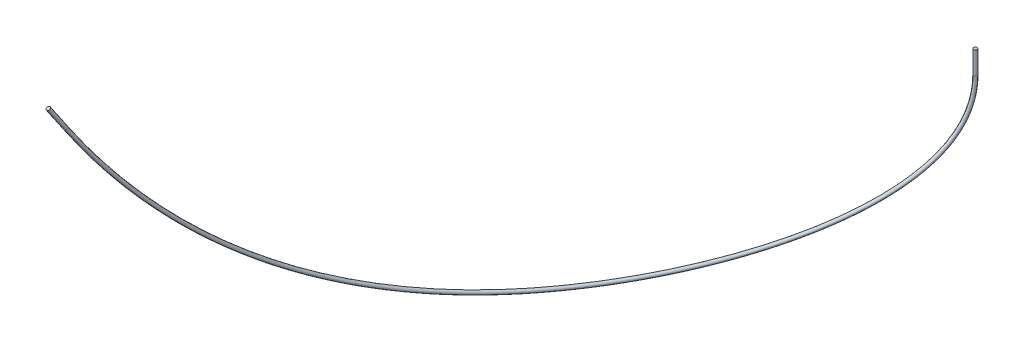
SolidWorks part; units mm, degrees
ref_plane "Front Plane" through (0, 0, 0) normal (0, 0, 1) x (1, 0, 0)
ref_plane "Top Plane" through (0, 0, 0) normal (0, 1, 0) x (1, 0, 0)
ref_plane "Right Plane" through (0, 0, 0) normal (1, 0, 0) x (0, 0, -1)
sketch3d "3DSketch1"
  line L0 (-6.8529, 80.1977, 284.8834) -> (-4.9485, 70.708, 279.0223) construction
  line L1 (129.032, 35.2425, 13.3985) -> (129.032, 25.2349, 13.3985) construction
  line L2 (-6.8529, 80.1977, 284.8834) -> (-4.9485, 70.708, 279.0223)
  line L3 (129.032, 35.2425, 13.3985) -> (129.032, 25.2349, 13.3985)
  spline S0 degree 3 poles (-2782.7074, -14650.3707, 668.3608) (873.5181, 3143.8482, -465.7221) (-835.5199, -1442.9994, 1362.79) (736.8262, 593.8716, -912.6707) (-7439.6142, 3712.3444, 12376.0381) knots -4.626939 -4.626939 -4.626939 -4.626939 0.550656 3.065442 3.065442 3.065442 3.065442 only from (-4.9485, 70.708, 279.0223) to (129.032, 25.2349, 13.3985) construction
  spline S1 degree 3 poles (-4.9485, 70.708, 279.0223) (4.7556, 22.3512, 249.156) (39.1667, -55.9997, 165.9552) (129.032, -22.4119, 13.3985) (129.032, 25.2349, 13.3985) knots 0 0 0 0 0.550656 1 1 1 1
ref_plane "Plane1" through (-6.8529, 80.1977, 284.8834) normal (0.1683, -0.8387, -0.518) x (0.9857, 0.1432, 0.0884)
sketch "PipeSketch" plane through (-6.8529, 80.1977, 284.8834) normal (0.1683, -0.8387, -0.518) x (0.9857, 0.1432, 0.0884)
  circle A0 centre (0, 0) radius 0.813
  dimension "OuterDiameter" = 1.626
sweep "Cable_1" add profiles "PipeSketch" path "3DSketch1"
